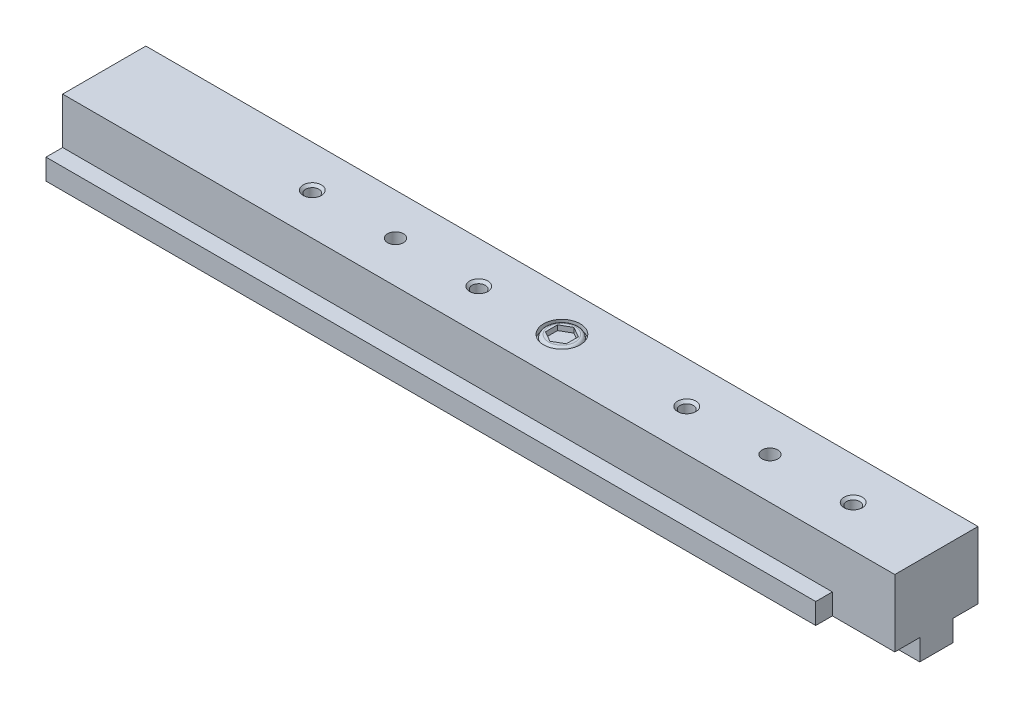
SolidWorks part; units mm, degrees
ref_plane "Front Plane" through (0, 0, 0) normal (0, 0, 1) x (1, 0, 0)
ref_plane "Top Plane" through (0, 0, 0) normal (0, 1, 0) x (1, 0, 0)
ref_plane "Right Plane" through (0, 0, 0) normal (1, 0, 0) x (0, 0, -1)
sketch "Sketch1" plane through (0, 0, 0) normal (1, 0, 0) x (0, 0, -1)
  line L0 (-8.89, 3.2258) -> (-2.54, 3.2258)
  line L1 (-2.54, 3.2258) -> (-2.54, 0)
  line L2 (-2.54, 0) -> (2.54, 0)
  line L3 (2.54, 0) -> (2.54, 3.2258)
  line L4 (2.54, 3.2258) -> (8.89, 3.2258)
  line L5 (8.89, 3.2258) -> (8.89, 6.4008)
  line L6 (8.89, 6.4008) -> (6.35, 6.4008)
  line L7 (6.35, 6.4008) -> (6.35, 13.462)
  line L8 (6.35, 13.462) -> (-6.35, 13.462)
  line L9 (-6.35, 13.462) -> (-6.35, 6.4008)
  line L10 (-6.35, 6.4008) -> (-8.89, 6.4008)
  line L11 (-8.89, 6.4008) -> (-8.89, 3.2258)
extrude "Extrude1" add sketch "Sketch1" along normal blind 117.475
ref_plane "Plane1" through (117.475, 0, 0) normal (1, 0, 0) x (0, 0, -1)
sketch "Sketch2" plane through (117.475, 0, 0) normal (1, 0, 0) x (0, 0, -1)
  line L0 (-6.35, 3.2258) -> (-2.54, 3.2258)
  line L1 (-2.54, 3.2258) -> (-2.54, 0)
  line L2 (-2.54, 0) -> (2.54, 0)
  line L3 (2.54, 0) -> (2.54, 3.2258)
  line L4 (2.54, 3.2258) -> (6.35, 3.2258)
  line L5 (6.35, 3.2258) -> (6.35, 13.462)
  line L6 (6.35, 13.462) -> (-6.35, 13.462)
  line L7 (-6.35, 13.462) -> (-6.35, 3.2258)
extrude "Extrude2" add sketch "Sketch2" along normal blind 9.525
ref_plane "Plane2" through (114.3, 0, 0) normal (1, 0, 0) x (0, 0, -1)
sketch "Sketch3" plane through (114.3, 0, 0) normal (1, 0, 0) x (0, 0, -1)
  line L0 (0, 13.462) -> (1.397, 13.462)
  line L1 (1.397, 13.462) -> (1.016, 13.081)
  line L2 (1.016, 13.081) -> (1.016, 5.7936)
  line L3 (1.016, 5.7936) -> (0, 5.207)
  line L4 (0, 5.207) -> (0, 13.462)
  line L5 (0, 5.207) -> (0, 13.462) construction
revolve "Cut-Revolve1" cut sketch "Sketch3" angle 360 about L5
ref_plane "Plane3" through (31.75, 0, 0) normal (1, 0, 0) x (0, 0, -1)
sketch "Sketch4" plane through (31.75, 0, 0) normal (1, 0, 0) x (0, 0, -1)
  line L0 (0, 13.462) -> (1.397, 13.462)
  line L1 (1.397, 13.462) -> (1.016, 13.081)
  line L2 (1.016, 13.081) -> (1.016, 7.6986)
  line L3 (1.016, 7.6986) -> (0, 7.112)
  line L4 (0, 7.112) -> (0, 13.462)
  line L5 (0, 7.112) -> (0, 13.462) construction
revolve "Cut-Revolve2" cut sketch "Sketch4" angle 360 about L5
ref_plane "Plane4" through (88.9, 0, 0) normal (1, 0, 0) x (0, 0, -1)
sketch "Sketch5" plane through (88.9, 0, 0) normal (1, 0, 0) x (0, 0, -1)
  line L0 (0, 13.462) -> (1.397, 13.462)
  line L1 (1.397, 13.462) -> (1.016, 13.081)
  line L2 (1.016, 13.081) -> (1.016, 5.7936)
  line L3 (1.016, 5.7936) -> (0, 5.207)
  line L4 (0, 5.207) -> (0, 13.462)
  line L5 (0, 5.207) -> (0, 13.462) construction
revolve "Cut-Revolve3" cut sketch "Sketch5" angle 360 about L5
ref_plane "Plane5" through (57.15, 0, 0) normal (1, 0, 0) x (0, 0, -1)
sketch "Sketch6" plane through (57.15, 0, 0) normal (1, 0, 0) x (0, 0, -1)
  line L0 (0, 13.462) -> (1.397, 13.462)
  line L1 (1.397, 13.462) -> (1.016, 13.081)
  line L2 (1.016, 13.081) -> (1.016, 5.7936)
  line L3 (1.016, 5.7936) -> (0, 5.207)
  line L4 (0, 5.207) -> (0, 13.462)
  line L5 (0, 5.207) -> (0, 13.462) construction
revolve "Cut-Revolve4" cut sketch "Sketch6" angle 360 about L5
ref_plane "Plane6" through (0, 13.462, 0) normal (0, 1, 0) x (-1, 0, 0)
sketch "Sketch7" plane through (0, 13.462, 0) normal (0, 1, 0) x (-1, 0, 0)
  circle A0 centre (-101.6, 0) radius 1.2027
extrude "Cut-Extrude1" cut sketch "Sketch7" against normal blind 3.048
sketch "Sketch8" plane through (0, 13.462, 0) normal (0, 1, 0) x (-1, 0, 0)
  circle A0 centre (-44.45, 0) radius 1.2027
extrude "Cut-Extrude2" cut sketch "Sketch8" against normal blind 3.048
sketch "Sketch9" plane through (0, 13.462, 0) normal (0, 1, 0) x (-1, 0, 0)
  circle A0 centre (-69.85, 0) radius 2.794
extrude "Cut-Extrude3" cut sketch "Sketch9" against normal blind 0.762
ref_plane "Plane7" through (69.85, 0, 0) normal (1, 0, 0) x (0, 0, -1)
sketch "Sketch10" plane through (69.85, 0, 0) normal (1, 0, 0) x (0, 0, -1)
  line L0 (0, 13.462) -> (2.032, 13.462)
  line L1 (2.54, 12.954) -> (2.54, 11.938)
  line L2 (2.54, 11.938) -> (0, 11.938)
  line L3 (0, 11.938) -> (0, 13.462)
  line L4 (0, 11.938) -> (0, 13.462) construction
  arc A0 (2.032, 13.462) -> (2.54, 12.954) centre (2.032, 12.954) cw
revolve "Revolve1" add sketch "Sketch10" angle 360 about L4
sketch "Sketch11" plane through (0, 13.462, 0) normal (0, 1, 0) x (-1, 0, 0)
  line L0 (-68.2625, -0.9165) -> (-68.2625, 0.9165)
  line L1 (-68.2625, 0.9165) -> (-69.85, 1.8331)
  line L2 (-69.85, 1.8331) -> (-71.4375, 0.9165)
  line L3 (-71.4375, 0.9165) -> (-71.4375, -0.9165)
  line L4 (-71.4375, -0.9165) -> (-69.85, -1.8331)
  line L5 (-69.85, -1.8331) -> (-68.2625, -0.9165)
extrude "Cut-Extrude4" cut sketch "Sketch11" against normal blind 0.762
ref_plane "Plane8" through (127, 0, 0) normal (1, 0, 0) x (0, 0, -1)
ref_plane "Plane9" through (74.5998, 0, 0) normal (1, 0, 0) x (0, 0, -1)
